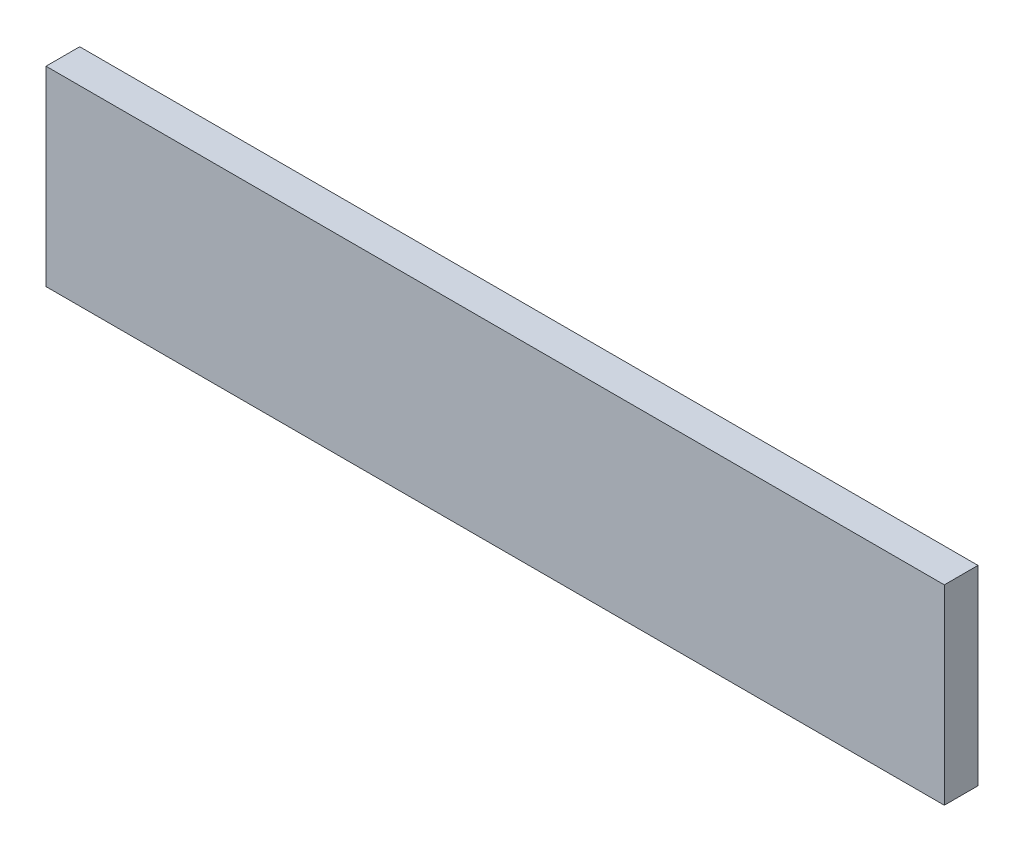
SolidWorks part; units mm, degrees
ref_plane "Alzado" through (0, 0, 0) normal (0, 0, 1) x (1, 0, 0)
ref_plane "Planta" through (0, 0, 0) normal (0, 1, 0) x (1, 0, 0)
ref_plane "Vista lateral" through (0, 0, 0) normal (1, 0, 0) x (0, 0, -1)
sketch "Croquis1" plane through (0, 0, 0) normal (0, 0, 1) x (1, 0, 0)
  line L1 (-200, 42.5) -> (200, 42.5)
  line L2 (-200, 42.5) -> (-200, -42.5)
  line L3 (-200, -42.5) -> (200, -42.5)
  line L4 (200, 42.5) -> (200, -42.5)
  line L5 (-200, 42.5) -> (200, -42.5) construction
  line L6 (-200, -42.5) -> (200, 42.5) construction
  point P0 (0, 0)
  dimension "D1" = 400
  dimension "D2" = 85
extrude "Saliente-Extruir1" add sketch "Croquis1" along normal blind 15
